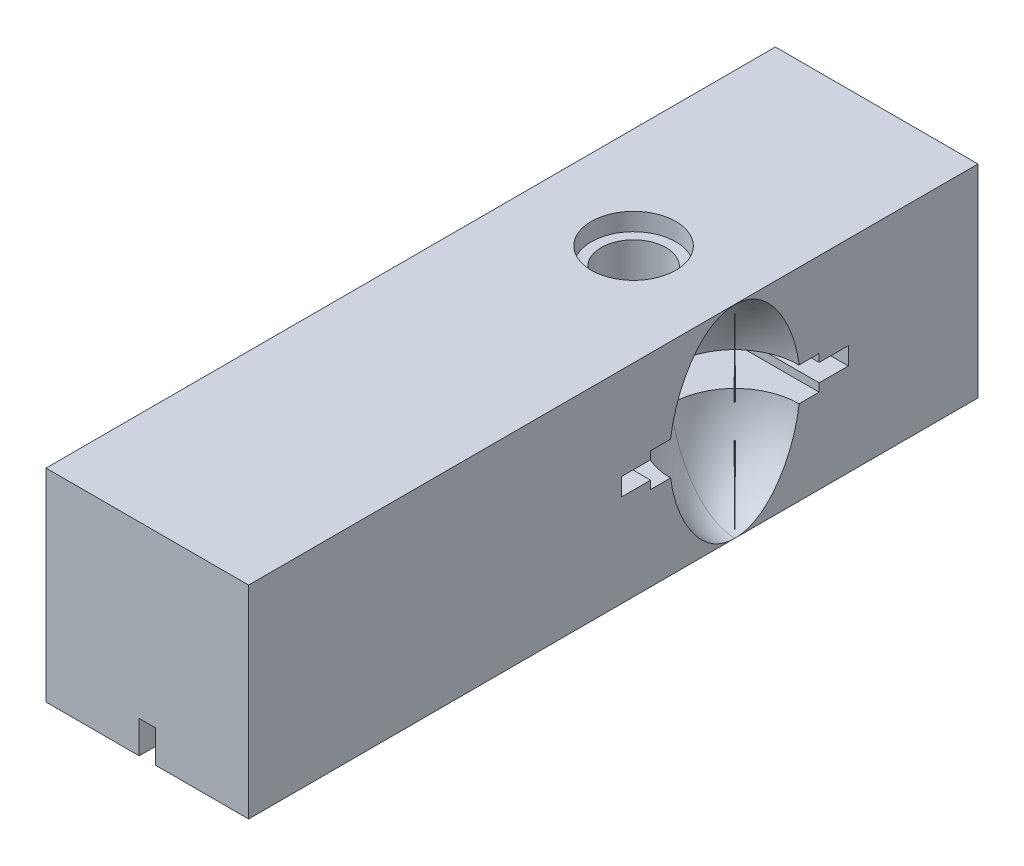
SolidWorks part; units mm, degrees
ref_plane "Front Plane" through (0, 0, 0) normal (0, 0, 1) x (1, 0, 0)
ref_plane "Top Plane" through (0, 0, 0) normal (0, 1, 0) x (1, 0, 0)
ref_plane "Right Plane" through (0, 0, 0) normal (1, 0, 0) x (0, 0, -1)
sketch "Sketch3" plane through (0, 0, 0) normal (0, 0, 1) x (1, 0, 0)
  line L1 (-9.4749, 12.9281) -> (3.0251, 12.9281)
  line L2 (-9.4749, 12.9281) -> (-9.4749, 0.4281)
  line L3 (-9.4749, 0.4281) -> (3.0251, 0.4281)
  line L4 (3.0251, 12.9281) -> (3.0251, 0.4281)
  dimension "D1" = 12.5
  dimension "D2" = 12.5
sketch "Sketch4" plane through (0, 0, 0) normal (0, 0, 1) x (1, 0, 0)
  line L0 (-9.4749, 12.9281) -> (3.0251, 12.9281)
  line L1 (-9.4749, 12.9281) -> (-9.4749, 0.4281)
  line L2 (-9.4749, 0.4281) -> (3.0251, 0.4281)
  line L3 (3.0251, 12.9281) -> (3.0251, 0.4281)
extrude "Boss-Extrude1" add sketch "Sketch4" along normal blind 45
sketch "Sketch6" plane through (0, 0, 0) normal (0, 1, 0) x (1, 0, 0)
  line L0 (-3.2249, 0) -> (-3.2249, -15) construction
  line L1 (-9.4749, 0) -> (3.0251, 0) construction
sketch "Sketch7" plane through (0, 0, 0) normal (0, 1, 0) x (1, 0, 0)
  circle A0 centre (-3.2249, -15) radius 1.5
  circle A1 centre (-3.2249, -15) radius 2.57
sketch "Sketch8" plane through (0, 0, 0) normal (0, 1, 0) x (1, 0, 0)
  circle A0 centre (-3.2249, -15) radius 2
extrude "Cut-Extrude1" cut sketch "Sketch8" along normal blind 13
sketch "Sketch11" plane through (0, 0, 0) normal (0, 1, 0) x (1, 0, 0)
  circle A0 centre (-3.2249, -15) radius 2.61
extrude "Cut-Extrude2" cut sketch "Sketch11" along normal blind 1.5
sketch "Sketch14" plane through (0, 0, 0) normal (1, 0, 0) x (0, 0, -1)
  line L0 (0, 6.6781) -> (-15, 6.6781) construction
  line L1 (0, 0.4281) -> (0, 12.9281) construction
sketch "Sketch15" plane through (0, 0, 0) normal (1, 0, 0) x (0, 0, -1)
  line L0 (-45, 0.4281) -> (0, 0.4281) construction
  line L1 (-22, 7.2231) -> (-8, 7.2231)
  line L2 (-22, 7.2231) -> (-22, 6.1331)
  line L3 (-22, 6.1331) -> (-8, 6.1331)
  line L4 (-8, 7.2231) -> (-8, 6.1331)
  line L5 (-45, 12.9281) -> (0, 12.9281) construction
  dimension "D1" = 1.09
  dimension "D2" = 14
  dimension "D3" = 5.705
  dimension "D4" = 5.705
  dimension "D5" = 14
  dimension "D6" = 7
  dimension "D7" = 5.705
extrude "Cut-Extrude3" cut sketch "Sketch15" against normal blind 9.5 and the other way blind 3.1
sketch "Sketch18" plane through (0, 0, 0) normal (1, 0, 0) x (0, 0, -1)
  line L0 (-15, 6.6781) -> (-15, 0) construction
  line L1 (0, 0) -> (-15, 0) construction
  line L2 (-22, 6.1331) -> (-8, 6.1331) construction
  line L3 (-20.2, 6.1331) -> (-9.8, 6.1331)
  line L4 (-20.2, 6.1331) -> (-20.2, 5.6331)
  line L5 (-20.2, 5.6331) -> (-9.8, 5.6331)
  line L6 (-9.8, 6.1331) -> (-9.8, 5.6331)
  dimension "D1" = 0.5
  dimension "D2" = 1.8
  dimension "D3" = 1.8
  dimension "D4" = 10.4
extrude "Cut-Extrude4" cut sketch "Sketch18" against normal blind 9.5 and the other way blind 3.1
ref_plane "Plane15" through (0, 6.6688, 0) normal (0, 1, 0) x (1, 0, 0)
mirror "Mirror1" about plane through (0, 6.6688, 0) normal (0, 1, 0) of "Cut-Extrude2"
sketch "Sketch20" plane through (0, 0.4281, 0) normal (0, -1, 0) x (1, 0, 0)
  line L0 (-3.2249, 45) -> (-3.2249, 36.2874) construction
  line L1 (-9.4749, 45) -> (3.0251, 45) construction
  line L2 (-3.2249, 45) -> (-3.7249, 45)
  line L3 (-3.7249, 39.5897) -> (-4.7249, 39.5897)
  line L4 (-4.7249, 39.5897) -> (-3.2249, 36.2874)
  line L5 (-3.2249, 36.2874) -> (-1.7249, 39.5897)
  line L6 (-1.7249, 39.5897) -> (-2.7249, 39.5897)
  line L7 (-2.7249, 39.5897) -> (-2.7249, 45)
  line L8 (-2.7249, 45) -> (-3.2249, 45)
  line L9 (-3.7249, 39.5897) -> (-3.7249, 45)
  dimension "D1" = 0.5
  dimension "D2" = 1
  dimension "D3" = 1
  dimension "D4" = 0.5
extrude "Cut-Extrude6" cut sketch "Sketch20" against normal blind 2
sketch "Sketch27" plane through (0, 0.4281, 0) normal (0, -1, 0) x (1, 0, 0)
sketch "Sketch32" plane through (0, 6.6688, 0) normal (0, 1, 0) x (1, 0, 0)
  line L0 (-3.2249, -15) -> (3.0251, -15) construction
  line L1 (3.0251, -45) -> (3.0251, 0) construction
  line L2 (3.0251, -15) -> (-9.4749, -15) construction
  line L3 (-9.4749, -45) -> (-9.4749, 0) construction
  line L4 (-0.9749, -15) -> (-0.9749, 0) construction
  arc A0 (3.0251, -19) -> (3.0251, -11) centre (3.0251, -15) cw
ref_plane "Plane16" through (0, 0.4281, 0) normal (0, 1, 0) x (1, 0, 0)
sketch "Sketch33" plane through (0, 0.4281, 0) normal (0, 1, 0) x (1, 0, 0)
  line L0 (3.0251, -45) -> (3.0251, 0) construction
  arc A0 (3.0251, -15.0307) -> (3.0251, -14.9706) centre (3.0251, -15.0007) cw
ref_plane "Plane17" through (0, 0, 15) normal (0, 0, 1) x (1, 0, 0)
sketch "Sketch46" plane through (0, 0, 15) normal (0, 0, 1) x (1, 0, 0)
  line L0 (-0.9749, 6.6688) -> (-0.9749, 13.5876) construction
  line L1 (3.0251, 6.6688) -> (-0.9749, 6.6688) construction
  line L2 (-3.2249, 6.6688) -> (3.0251, 6.6688) construction
sketch "Sketch49" plane through (0, 0, 15) normal (0, 0, 1) x (1, 0, 0)
  line L0 (3.023, 0.4297) -> (2.9823, 6.6688)
  line L1 (2.9823, 6.6688) -> (-0.9749, 6.6688)
  spline S0 degree 3 poles (-0.9749, 6.6688) (-1.1233, 4.302) (0.4935, 0.4277) (3.0136, 0.4296) (3.023, 0.4297) knots 0 0 0 0 0.996259 1 1 1 1
sweep "Cut-Sweep1" cut profiles "Sketch49" path "Sketch32"
mirror "Mirror2" about plane through (0.0219, 2.6522, 15) normal (0, 0, -1) of "Cut-Sweep1"
mirror "Mirror11" about plane through (0, 6.6688, 0) normal (0, 1, 0) of "Cut-Sweep1"
mirror "Mirror12" about plane through (0, 0, 15) normal (0, 0, 1) of "Mirror11"
ref_plane "Plane18" through (-3.225, 0, 0) normal (1, 0, 0) x (0, 0, -1)
mirror "Mirror15" about plane through (-3.225, 0, 0) normal (1, 0, 0) of "Mirror11", "Cut-Sweep1"
mirror "Mirror16" about plane through (0, 0, 15) normal (0, 0, 1) of "Mirror15"
mirror "Mirror17" about plane through (0, 6.6688, 0) normal (0, 1, 0) of "Cut-Extrude4"
sketch "Sketch50" plane through (0, 0.4281, 0) normal (0, 1, 0) x (1, 0, 0)
  line L0 (-7.1365, -43.8752) -> (-7.1365, -32.131) construction
  line L1 (-7.1365, -43.8752) -> (-4.9482, -43.8752) construction
  line L2 (-8.5387, -43.8752) -> (-8.5387, -32.1978) construction
sketch "Sketch51" plane through (0, 0.4281, 0) normal (0, 1, 0) x (1, 0, 0)
  text T0 "Model A - V6" font "Century Gothic" height in points 5
  text T1 "Perovskite" font "Century Gothic" height in points 4
extrude "Cut-Extrude7" cut sketch "Sketch51" against normal blind 2
